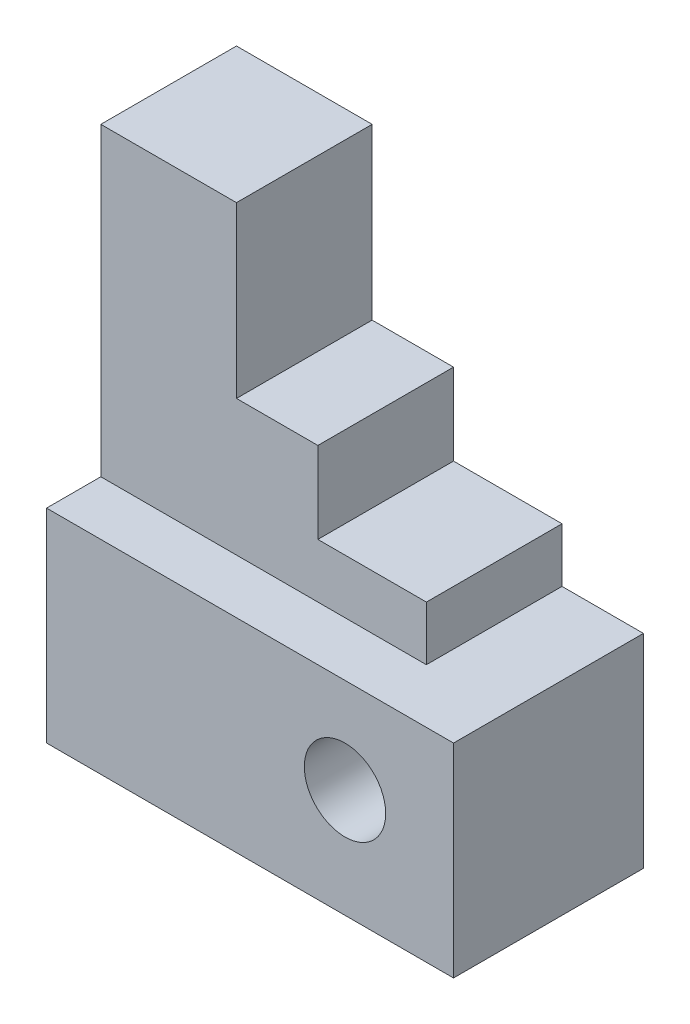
SolidWorks part; units mm, degrees
ref_plane "Front Plane" through (0, 0, 0) normal (0, 0, 1) x (1, 0, 0)
ref_plane "Top Plane" through (0, 0, 0) normal (0, 1, 0) x (1, 0, 0)
ref_plane "Right Plane" through (0, 0, 0) normal (1, 0, 0) x (0, 0, -1)
sketch "Sketch1" plane through (0, 0, 0) normal (0, 0, 1) x (1, 0, 0)
  line L0 (32, 38) -> (48, 38)
  line L1 (0, 0) -> (60, 0)
  line L2 (0, 0) -> (0, 30)
  line L3 (0, 30) -> (60, 30)
  line L4 (60, 0) -> (60, 30)
  line L5 (0, 30) -> (48, 30)
  line L6 (0, 30) -> (0, 50)
  line L10 (0, 50) -> (0, 75)
  line L11 (0, 75) -> (20, 75)
  line L12 (20, 50) -> (20, 75)
  line L13 (20, 50) -> (32, 50)
  line L16 (32, 50) -> (32, 38)
  line L17 (48, 38) -> (32, 38)
  line L18 (48, 38) -> (48, 30)
  line L19 (0, 30) -> (0, 50)
  line L21 (60, 0) -> (44, 0)
  line L22 (60, 0) -> (60, 16)
  circle A0 centre (44, 16) radius 6
  dimension "D6" = 16
  dimension "D9" = 12
  dimension "D1" = 30
  dimension "D2" = 60
  dimension "D3" = 20
  dimension "D4" = 75
  dimension "D5" = 20
  dimension "D7" = 12
  dimension "D8" = 16
extrude "Boss-Extrude4" add sketch "Sketch1" along normal blind 28 contours L1 L4 L3 L2 A0
sketch "Sketch5" plane through (0, 0, 0) normal (0, 0, 1) x (1, 0, 0)
  line L1 (20, 75) -> (0, 75)
  line L2 (20, 75) -> (20, 50)
  line L3 (20, 50) -> (0, 50)
  line L4 (0, 75) -> (0, 50)
  line L5 (32, 50) -> (0, 50)
  line L6 (32, 50) -> (32, 30)
  line L7 (32, 30) -> (0, 30)
  line L8 (0, 50) -> (0, 30)
  line L9 (48, 38) -> (32, 38)
  line L10 (48, 38) -> (48, 30)
  line L11 (48, 30) -> (32, 30)
  line L12 (32, 38) -> (32, 30)
extrude "Boss-Extrude5" add sketch "Sketch5" along normal blind 20 contours L1 L4 L3 L2 | L3 L8 L7 L6 L5 | L11 L10 L9 L6
